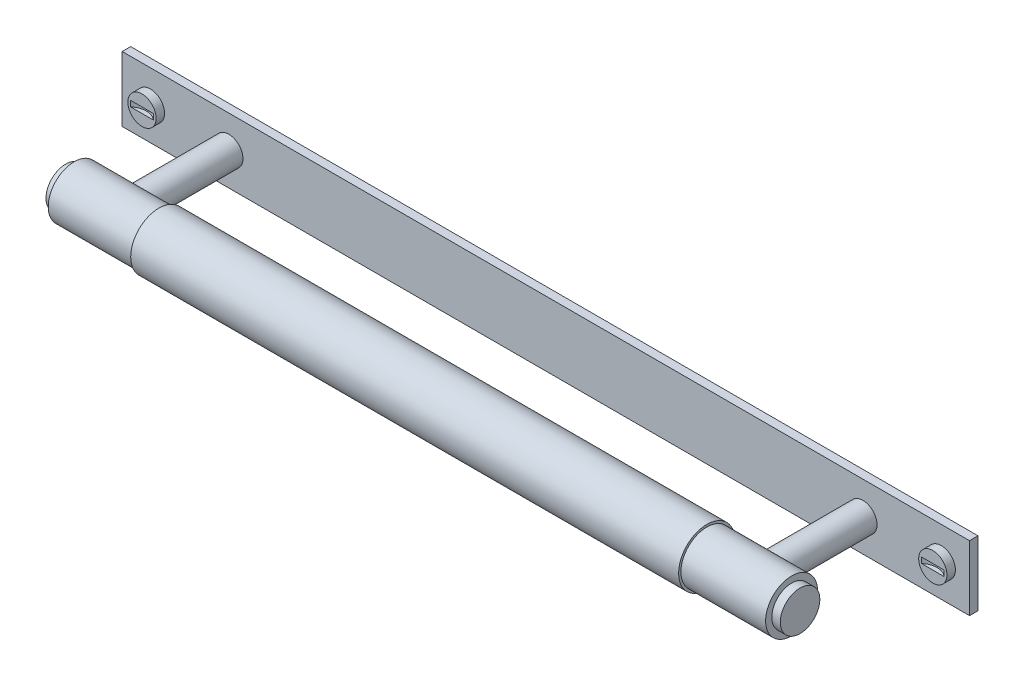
SolidWorks part; units mm, degrees
ref_plane "Front Plane" through (0, 0, 0) normal (0, 0, 1) x (1, 0, 0)
ref_plane "Top Plane" through (0, 0, 0) normal (0, 1, 0) x (1, 0, 0)
ref_plane "Right Plane" through (0, 0, 0) normal (1, 0, 0) x (0, 0, -1)
sketch "Sketch1" plane through (0, 0, 0) normal (1, 0, 0) x (0, 0, -1)
  circle A0 centre (0, 0) radius 10
  dimension "D1" = 20
extrude "Boss-Extrude1" add sketch "Sketch1" along normal blind 97
sketch "Sketch2" plane through (97, 0, 0) normal (1, 0, 0) x (0, 0, -1)
  circle A2 centre (0, 0) radius 9.2
  circle A3 centre (0, 0) radius 9.2
  dimension "D1" = 0.8
extrude "Boss-Extrude3" add sketch "Sketch2" along normal blind 30
sketch "Sketch3" plane through (127, 0, 0) normal (1, 0, 0) x (0, 0, -1)
  circle A0 centre (0, 0) radius 7
extrude "Boss-Extrude4" add sketch "Sketch3" along normal blind 3
mirror "Mirror1" about plane through (0, 0, 0) normal (1, 0, 0) of "Boss-Extrude4", "Boss-Extrude3", "Boss-Extrude1"
sketch "Sketch4" plane through (0, 0, 0) normal (0, 0, 1) x (1, 0, 0)
  line L0 (-130, 0) -> (-117.25, 0) construction
  line L1 (-130, 7) -> (-130, -7) construction
  line L2 (-117.25, 0) -> (-107.25, 0) construction
  line L3 (-112.25, 0) -> (-130, 0) construction
  circle A0 centre (-112.25, 0) radius 5
  dimension "D2" = 10
  dimension "D1" = 17.75
extrude "Boss-Extrude5" add sketch "Sketch4" against normal blind 40
mirror "Mirror2" about plane through (0, 0, 0) normal (1, 0, 0) of "Boss-Extrude5"
sketch "Sketch9" plane through (0, 0, 0) normal (1, 0, 0) x (0, 0, -1)
  line L2 (40, -11.5) -> (40, 11.5)
  line L3 (40, 11.5) -> (43, 11.5)
  line L4 (43, -11.5) -> (43, 11.5)
  line L5 (40, -11.5) -> (43, -11.5)
extrude "Boss-Extrude8" add sketch "Sketch9" along normal mid plane 300
sketch "Sketch10" plane through (0, 0, -40) normal (0, 0, 1) x (1, 0, 0)
  line L0 (0, 0) -> (140, 0) construction
  line L1 (150, 11.5) -> (150, -11.5) construction
  circle A0 centre (140, 0) radius 5
  point P4 (150, 0)
  dimension "D1" = 10
  dimension "D2" = 10
extrude "Boss-Extrude9" add sketch "Sketch10" along normal blind 3 contours A0
sketch "Sketch11" plane through (0, 0, 0) normal (0, 1, 0) x (1, 0, 0)
  line L0 (140, 37) -> (140, 38.5) construction
  line L1 (135, 37) -> (145, 37) construction
  line L2 (135, 37) -> (136, 37) construction
  line L3 (145, 37) -> (144, 37) construction
  line L6 (136, 37) -> (136, 34.6346)
  line L7 (136, 34.6346) -> (144, 34.6346)
  line L8 (144, 37) -> (144, 34.6346)
  arc A0 (136, 37) -> (144, 37) centre (140, 32.5279) cw
  dimension "D3" = 6
  dimension "D1" = 1
  dimension "D2" = 1
extrude "Cut-Extrude1" cut sketch "Sketch11" against normal mid plane 2
mirror "Mirror3" about plane through (0, 0, 0) normal (1, 0, 0) of "Cut-Extrude1", "Boss-Extrude9"
sketch "Sketch13" [suppressed] plane through (0, 0, -40) normal (0, 0, -1) x (-1, 0, 0)
  circle A0 centre (-362.25, 0) radius 12
  dimension "D1" = 24
extrude "Boss-Extrude10" [suppressed] add sketch "Sketch13" along normal blind 3
mirror "Mirror4" [suppressed] about plane through (0, 0, 0) normal (1, 0, 0)
